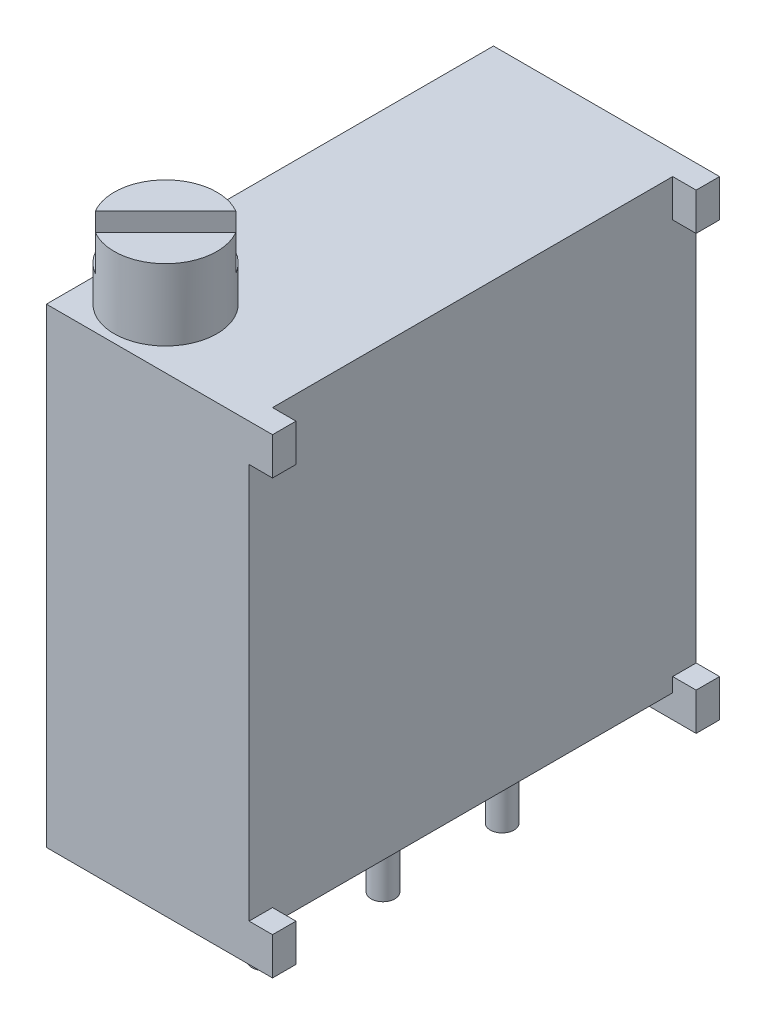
SolidWorks part; units mm, degrees
ref_plane "Front" through (0, 0, 0) normal (0, 0, 1) x (1, 0, 0)
ref_plane "Top" through (0, 0, 0) normal (0, 1, 0) x (1, 0, 0)
ref_plane "Right" through (0, 0, 0) normal (1, 0, 0) x (0, 0, -1)
sketch "Эскиз1" plane through (0, 0, 0) normal (1, 0, 0) x (0, 0, -1)
  line L0 (6.805, 0) -> (7.305, 0)
  line L1 (-2.225, 0) -> (-1.725, 0)
  line L2 (-2.225, 0) -> (-2.225, 10.03)
  line L3 (-2.225, 10.03) -> (7.305, 10.03)
  line L4 (7.305, 0) -> (7.305, 10.03)
  line L5 (2.54, 0.5) -> (2.54, 10.03) construction
  line L6 (-1.725, 0) -> (-1.725, 0.5)
  line L7 (-1.725, 0.5) -> (6.805, 0.5)
  line L8 (6.805, 0) -> (6.805, 0.5)
  dimension "D1" = 10.03
  dimension "D2" = 0.5
  dimension "D3" = 9.53
  dimension "D4" = 0.5
  dimension "D5" = 2.54
extrude "Вытянуть1" add sketch "Эскиз1" along normal mid plane 4.82
sketch "Эскиз2" plane through (2.41, 0, 0) normal (1, 0, 0) x (0, 0, -1)
  line L0 (-2.225, 10.03) -> (-2.225, 0) construction
  line L1 (-1.725, 0) -> (-2.225, 0)
  line L2 (-1.725, 0) -> (-1.725, 0.8)
  line L3 (-1.725, 0.8) -> (-2.225, 0.8)
  line L4 (-2.225, 0) -> (-2.225, 0.8)
  line L5 (2.54, 10.03) -> (2.54, 0.5) construction
  line L6 (-2.225, 10.03) -> (-1.725, 10.03)
  line L7 (-2.225, 10.03) -> (-2.225, 9.23)
  line L8 (-2.225, 9.23) -> (-1.725, 9.23)
  line L9 (-1.725, 10.03) -> (-1.725, 9.23)
  line L10 (7.305, 10.03) -> (-2.225, 10.03) construction
  line L11 (-1.725, 0.5) -> (6.805, 0.5) construction
  line L12 (6.805, 10.03) -> (6.805, 9.23)
  line L13 (7.305, 9.23) -> (6.805, 9.23)
  line L14 (7.305, 10.03) -> (7.305, 9.23)
  line L15 (7.305, 10.03) -> (6.805, 10.03)
  line L16 (7.305, 0) -> (7.305, 0.8)
  line L17 (6.805, 0.8) -> (7.305, 0.8)
  line L18 (6.805, 0) -> (6.805, 0.8)
  line L19 (6.805, 0) -> (7.305, 0)
  dimension "D1" = 0.8
extrude "Вырез-Вытянуть1" cut sketch "Эскиз2" against normal blind 0.5 flip side to cut
sketch "Эскиз3" plane through (0, 0.5, 0) normal (0, -1, 0) x (1, 0, 0)
  circle A0 centre (0, 0) radius 0.255
  circle A1 centre (0, -2.54) radius 0.255
  circle A2 centre (0, -5.08) radius 0.255
  dimension "D1" = 2.54
  dimension "D2" = 0.51
extrude "Вытянуть2" add sketch "Эскиз3" along normal blind 2.5
sketch "Эскиз4" plane through (0, 10.03, 0) normal (0, 1, 0) x (-1, 0, 0)
  line L0 (2.41, -7.305) -> (2.41, 2.225) construction
  line L1 (-2.41, 2.225) -> (2.41, 2.225) construction
  circle A0 centre (1.14, 0.955) radius 1.095
  dimension "D1" = 1.27
  dimension "D3" = 2.19
  dimension "D2" = 1.27
extrude "Вытянуть3" add sketch "Эскиз4" along normal blind 1.52
sketch "Эскиз5" plane through (0, 11.55, 0) normal (0, 1, 0) x (-1, 0, 0)
  line L0 (1.7163, 1.9273) -> (0.1677, 0.3787)
  line L1 (1.7163, 1.9273) -> (2.1123, 1.5313)
  line L2 (0.1677, 0.3787) -> (0.5637, -0.0173)
  line L3 (2.1123, 1.5313) -> (0.5637, -0.0173)
  line L5 (2.235, 0.955) -> (0.045, 0.955) construction
  line L6 (0.3657, 0.1807) -> (1.9143, 1.7293) construction
  circle A0 centre (1.14, 0.955) radius 1.095 construction
  circle A1 centre (1.14, 0.955) radius 1.095 construction
  point P12 (1.14, 0.955)
  dimension "D1" = 0.56
  dimension "D2" = 45
extrude "Вырез-Вытянуть2" cut sketch "Эскиз5" against normal blind 0.76
